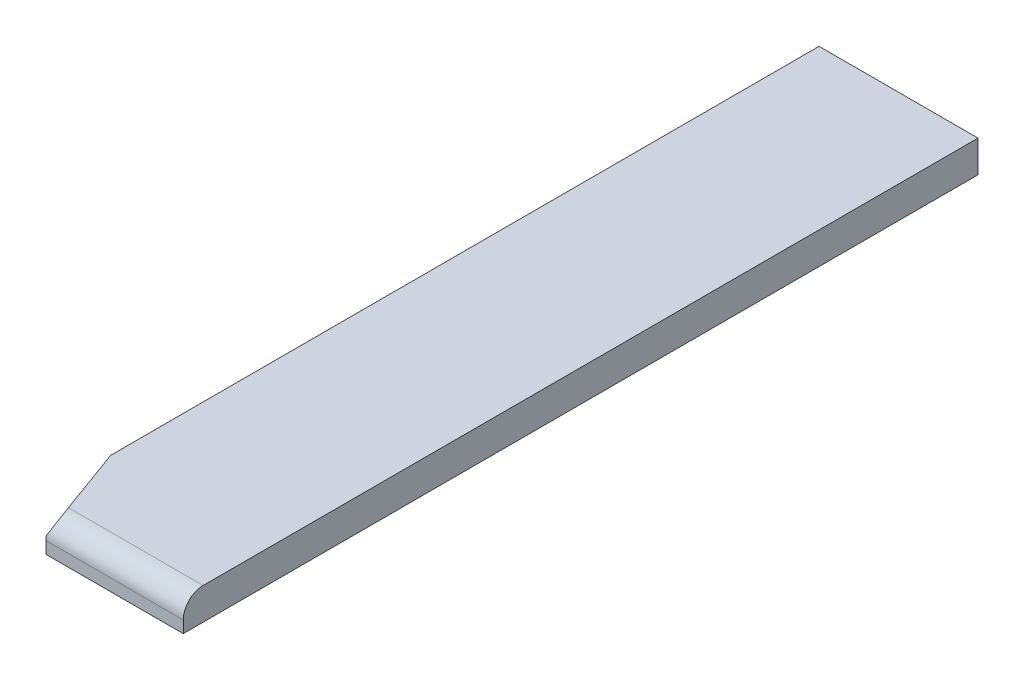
SolidWorks part; units mm, degrees
ref_plane "Plan de face" through (0, 0, 0) normal (0, 0, 1) x (1, 0, 0)
ref_plane "Plan de dessus" through (0, 0, 0) normal (0, 1, 0) x (1, 0, 0)
ref_plane "Plan de droite" through (0, 0, 0) normal (1, 0, 0) x (0, 0, -1)
mirrored part "GP030266_Rendre symétrique"
other "<GP030266>-<Enlèv. mat.-Extru.2>"
ref_plane "Plan1" through (0, 0, -70) normal (0, 0, 1) x (1, 0, 0)
